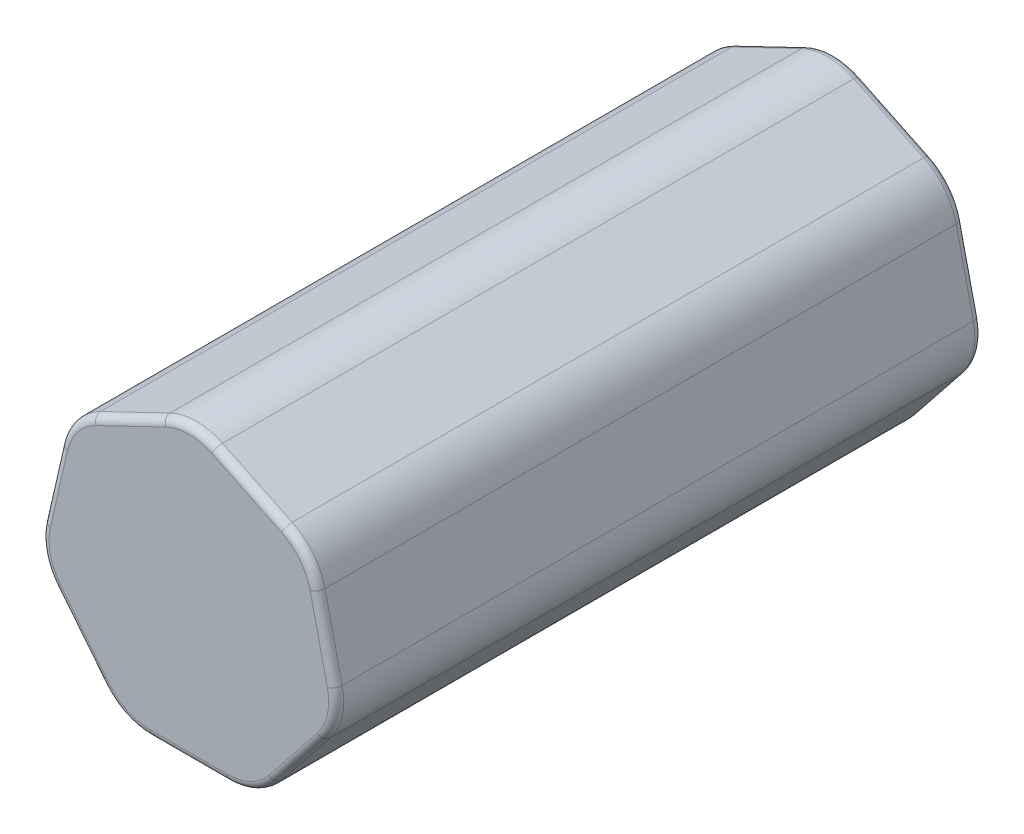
SolidWorks part; units mm, degrees
ref_plane "Front Plane" through (0, 0, 0) normal (0, 0, 1) x (1, 0, 0)
ref_plane "Top Plane" through (0, 0, 0) normal (0, 1, 0) x (1, 0, 0)
ref_plane "Right Plane" through (0, 0, 0) normal (1, 0, 0) x (0, 0, -1)
sketch "Sketch1" plane through (0, 0, 0) normal (0, 0, 1) x (1, 0, 0)
  line L1 (25.6781, 20.4776) -> (0, 32.8435)
  line L2 (0, 32.8435) -> (-25.6781, 20.4776)
  line L3 (-25.6781, 20.4776) -> (-32.0201, -7.3084)
  line L4 (-32.0201, -7.3084) -> (-14.2503, -29.591)
  line L5 (-14.2503, -29.591) -> (14.2503, -29.591)
  line L6 (14.2503, -29.591) -> (32.0201, -7.3084)
  line L7 (32.0201, -7.3084) -> (25.6781, 20.4776)
  circle A0 centre (0, 0) radius 29.591 construction
  dimension "D1" = 59.182
extrude "Boss-Extrude1" add sketch "Sketch1" along normal mid plane 135.89
fillet "Fillet1" radius 12.7 7 edges at (-32.0201, -7.3084, 0) (-14.2503, -29.591, 0) (14.2503, -29.591, 0) (32.0201, -7.3084, 0) (25.6781, 20.4776, 0) (0, 32.8435, 0) (-25.6781, 20.4776, 0)
fillet "Fillet2" radius 1.5875 28 edges at (-24.5867, 19.6073, 67.945) (-12.8391, 26.6606, 67.945) (0, 31.4476, 67.945) (12.8391, 26.6606, 67.945) (24.5867, 19.6073, 67.945) (28.8491, 6.5846, 67.945) (30.6591, -6.9977, 67.945) (23.1352, -18.4497, 67.945) (13.6446, -28.3333, 67.945) (0, -29.591, 67.945) (-13.6446, -28.3333, 67.945) (-23.1352, -18.4497, 67.945) (-30.6591, -6.9977, 67.945) (-28.8491, 6.5846, 67.945) (-13.6446, -28.3333, -67.945) (0, -29.591, -67.945) (13.6446, -28.3333, -67.945) (23.1352, -18.4497, -67.945) (30.6591, -6.9977, -67.945) (28.8491, 6.5846, -67.945) (24.5867, 19.6073, -67.945) (12.8391, 26.6606, -67.945) (0, 31.4476, -67.945) (-12.8391, 26.6606, -67.945) (-24.5867, 19.6073, -67.945) (-28.8491, 6.5846, -67.945) (-30.6591, -6.9977, -67.945) (-23.1352, -18.4497, -67.945)
